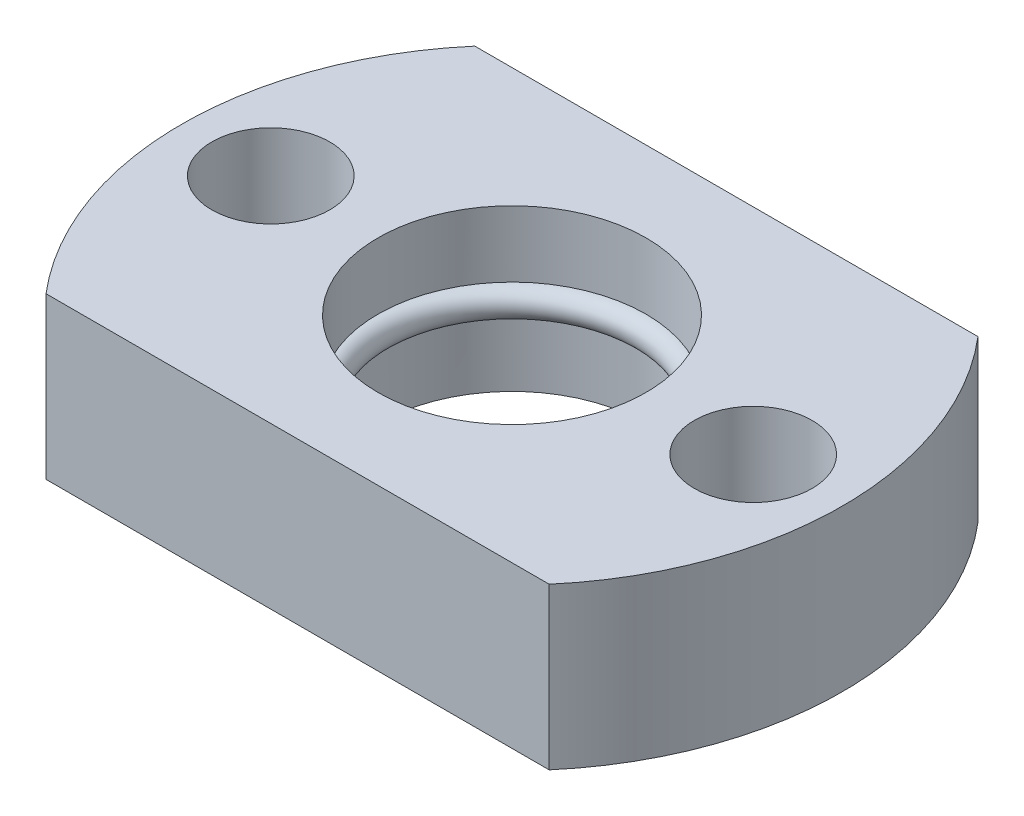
SolidWorks part; units mm, degrees
ref_plane "Front Plane" through (0, 0, 0) normal (0, 0, 1) x (1, 0, 0)
ref_plane "Top Plane" through (0, 0, 0) normal (0, 1, 0) x (1, 0, 0)
ref_plane "Right Plane" through (0, 0, 0) normal (1, 0, 0) x (0, 0, -1)
sketch "Sketch2" plane through (0, 0, 0) normal (0, 1, 0) x (1, 0, 0)
  line L0 (-14.0801, 12) -> (14.0801, 12)
  line L5 (-14.0801, -12) -> (14.0801, -12)
  line L6 (-13.5, 0) -> (13.5, 0) construction
  circle A0 centre (0, 0) radius 7.5
  arc A1 (-14.0801, 12) -> (-14.0801, -12) centre (0, 0) ccw
  arc A2 (14.0801, -12) -> (14.0801, 12) centre (0, 0) ccw
  circle A3 centre (-13.5, 0) radius 3.3
  circle A4 centre (13.5, 0) radius 3.3
  dimension "D1" = 15
  dimension "D2" = 37
  dimension "D5" = 6.6
  dimension "D3" = 24
  dimension "D4" = 27
extrude "Boss-Extrude1" add sketch "Sketch2" along normal mid plane 9
sketch "Sketch3" plane through (0, 0, 0) normal (0, 0, 1) x (1, 0, 0)
  line L0 (0, 0) -> (0, 4.5) construction
  line L1 (-14.0801, 4.5) -> (14.0801, 4.5) construction
  line L2 (0, 0) -> (-7.5, 0) construction
  circle A0 centre (-7.5, 0) radius 0.8
  dimension "D1" = 1.6
  dimension "D2" = 15
revolve "Revolve1" add sketch "Sketch3" angle 360 about L0
